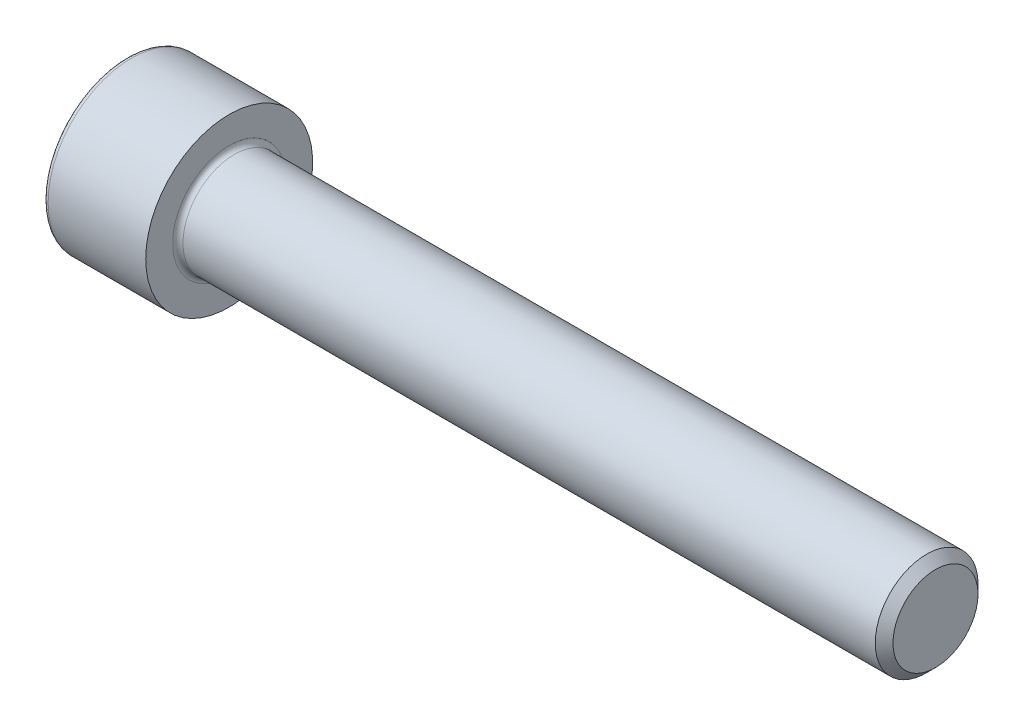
SolidWorks part; units mm, degrees
ref_plane "Plane1" through (0, 0, 0) normal (0, 0, 1) x (1, 0, 0)
ref_plane "Plane2" through (0, 0, 0) normal (0, 1, 0) x (1, 0, 0)
ref_plane "Plane3" through (0, 0, 0) normal (1, 0, 0) x (0, 0, -1)
sketch "BodySke" plane through (0, 0, 0) normal (0, 0, 1) x (1, 0, 0)
  line L0 (0, 0) -> (0, 6.5)
  line L1 (0, 6.5) -> (8, 6.5)
  line L2 (8, 6.5) -> (8, 4)
  line L3 (8, 4) -> (62.3095, 4)
  line L4 (63, 3.3095) -> (63, 0)
  line L5 (63, 0) -> (0, 0)
  line L6 (-31.75, 0) -> (127, 0) construction
  line L8 (63, 3.3095) -> (62.3095, 4)
  line L10 (63, -3.3095) -> (62.3095, -4) construction
  line L11 (9.25, 9.525) -> (9.25, 3.175) construction
  line L12 (8, 9.525) -> (8, 3.175) construction
  line L13 (3, 9.525) -> (3, 3.175) construction
  dimension "Diameter" = 8
  dimension "Head_ht" = 8
  dimension "Length" = 55
  dimension "Body_ch_ang" = 45
  dimension "Head_dia" = 13
  dimension "Minor_dia" = 6.619
  dimension "Advance" = 1.25
  dimension "Thread_nom" = 55
  dimension "Thread_length" = 60
revolve "Base-Revolve" add sketch "BodySke"
fillet "Fillet1" radius 0.4 1 edges at (8, 0, 4)
fillet "Fillet2" radius 0.4 1 edges at (0, 0, 6.5)
sketch "Sketch2" plane through (0, 0, 0) normal (0, 0, 1) x (1, 0, 0)
  line L0 (0, 3.0475) -> (4, 3.0475)
  line L1 (4, 3.0475) -> (5.7595, 0)
  line L2 (-31.75, 0) -> (127, 0) construction
  line L3 (5.7595, 0) -> (0, 0)
  line L4 (0, 0) -> (0, 3.0475)
  line L6 (0, 0) -> (47.625, 0) construction
  dimension "D1" = 3.0475
  dimension "D2" = 60
  dimension "Depth" = 4
revolve "Hex-PreBroach" cut sketch "Sketch2" angle 360 about L6
sketch "Sketch3" plane through (0, 0, 0) normal (-1, 0, 0) x (0, 0.5, 0.866)
  line L0 (1.7595, 3.0475) -> (-1.7595, 3.0475)
  line L1 (-1.7595, 3.0475) -> (-3.5189, 0)
  line L2 (1.7595, 3.0475) -> (3.5189, 0)
  line L3 (1.7595, -3.0475) -> (3.5189, 0)
  line L4 (1.7595, -3.0475) -> (-1.7595, -3.0475)
  line L5 (-1.7595, -3.0475) -> (-3.5189, 0)
  dimension "D1" = 3.0475
  dimension "D2" = 3.0475
  dimension "Hex_size" = 6.095
extrude "Hex" cut sketch "Sketch3" against normal blind 4
sketch "ThdSchSke" plane through (0, 0, 0) normal (0, 0, 1) x (1, 0, 0)
  line L0 (11.75, -3.3095) -> (11.2665, -4)
  line L1 (11.75, -3.3095) -> (12.2335, -4)
  line L2 (12.2335, -4) -> (12.2335, -5)
  line L3 (-3.175, 0) -> (5.1513, 0) construction
  line L4 (0, 6.1) -> (0, -6.1) construction
  line L5 (12.2335, -5) -> (11.2665, -5)
  line L6 (11.2665, -5) -> (11.2665, -4)
  dimension "Thread_minor" = 6.619
  dimension "Diameter" = 8
  dimension "Start" = 11.75
  dimension "SideAngle" = 55
  dimension "VeeAngle" = 70
  dimension "Overcut" = 10
revolve "ThreadSchematic" [suppressed] cut sketch "ThdSchSke" angle 360 about L3
pattern_linear "ThdSchPat" [suppressed]
equation "\"D2@Sketch3\" = \"Hex_size@Sketch3\" / 2"
equation "\"D1@Sketch3\" = \"Hex_size@Sketch3\" / 2"
equation "\"D1@Sketch2\" = \"Hex_size@Sketch3\" / 2"
equation "\"Thread_minor@ThreadCosmetic\"  =  \"Minor_dia@BodySke\""
equation "\"Depth@Sketch2\" =  \"Key_eng@Hex\""
equation "\"Thread_length@ThreadCosmetic\" = ((sgn( (\"Length@BodySke\" - \"Advance@BodySke\" * 3.0) - \"Thread_nom@BodySke\" )-1)*( (\"Length@BodySke\" - \"Advance@BodySke\" * 3.0) - \"Thread_nom@BodySke\" ))/-2+ \"Thread_no"
equation "\"Thread_minor@ThdSchSke\" = \"Minor_dia@BodySke\""
equation "\"Diameter@ThdSchSke\" = \"Diameter@BodySke\""
equation "\"Overcut@ThdSchSke\" = \"Diameter@BodySke\" * 1.25"
equation "\"Start@ThdSchSke\" = \"Head_ht@BodySke\" + \"Length@BodySke\" - \"Thread_length@ThreadCosmetic\"  '---Non-countersunk---"
equation "\"Num_threads@ThdSchPat\" = int( \"Thread_length@ThreadCosmetic\" / \"Advance@BodySke\" + 0.999 )  + 1"
equation "\"Advance@ThdSchPat\" = \"Thread_length@ThreadCosmetic\" /  (\"Num_threads@ThdSchPat\" - 1) 'relax it"
equation "\"Num_threads@ThdSchPat\" = \"Num_threads@ThdSchPat\" - sgn( \"Num_threads@ThdSchPat\" - 1) '---chamfered tips only---"
